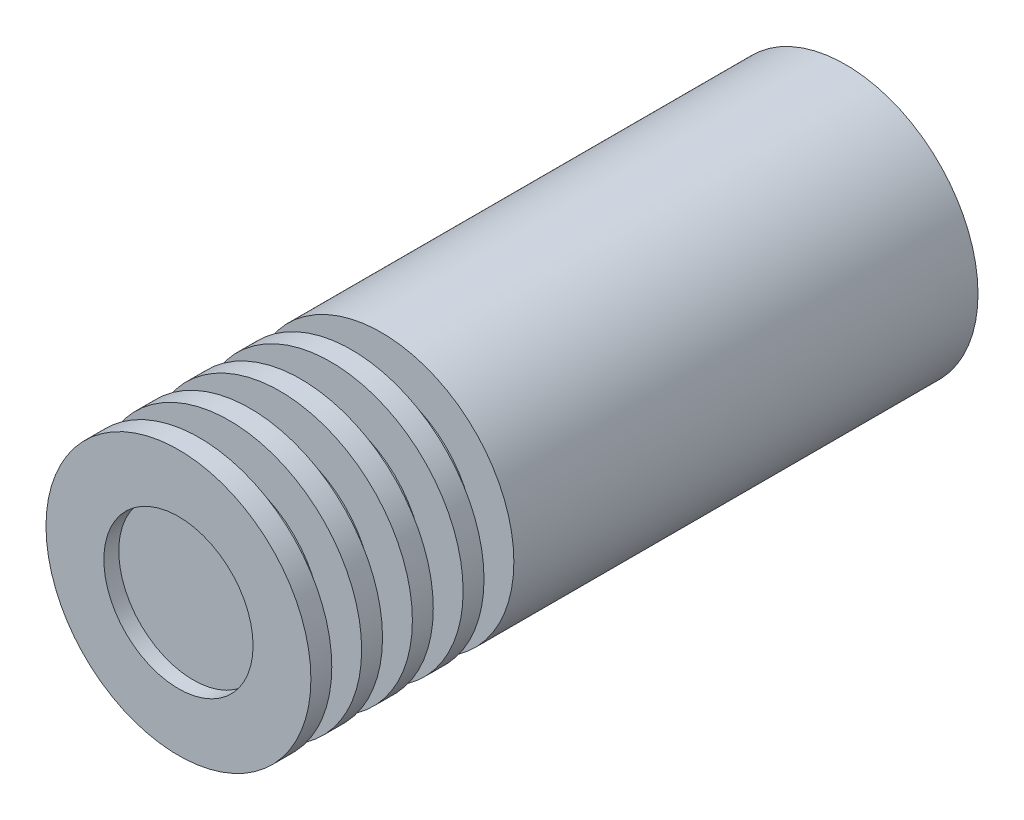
SolidWorks part; units mm, degrees
ref_plane "Ebene vorne" through (0, 0, 0) normal (0, 0, 1) x (1, 0, 0)
ref_plane "Ebene oben" through (0, 0, 0) normal (0, 1, 0) x (1, 0, 0)
ref_plane "Ebene rechts" through (0, 0, 0) normal (1, 0, 0) x (0, 0, -1)
sketch "Sketch1" plane through (0, 0, 0) normal (0, 0, 1) x (1, 0, 0)
  circle A0 centre (0, 0) radius 8.875
  dimension "D1" = 17.75
extrude "Boss-Extrude1" add sketch "Sketch1" along normal blind 44.7
sketch "Sketch2" plane through (0, 0, 0) normal (1, 0, 0) x (0, 0, -1)
  line L0 (0, 8.875) -> (-44.7, 8.875) construction
  line L1 (-43.3, 8.875) -> (-41.3, 8.875)
  line L2 (-43.3, 8.875) -> (-43.3, 6.175)
  line L3 (-43.3, 6.175) -> (-41.3, 6.175)
  line L4 (-41.3, 8.875) -> (-41.3, 6.175)
  line L5 (-44.7, 8.875) -> (-44.7, -8.875) construction
  line L6 (-39.9, 8.875) -> (-37.9, 8.875)
  line L7 (-39.9, 8.875) -> (-39.9, 6.175)
  line L8 (-39.9, 6.175) -> (-37.9, 6.175)
  line L9 (-37.9, 8.875) -> (-37.9, 6.175)
  line L10 (-36.5, 8.875) -> (-34.5, 8.875)
  line L11 (-36.5, 8.875) -> (-36.5, 6.175)
  line L12 (-36.5, 6.175) -> (-34.5, 6.175)
  line L13 (-34.5, 8.875) -> (-34.5, 6.175)
  line L14 (-33.1, 8.875) -> (-31.1, 8.875)
  line L15 (-33.1, 8.875) -> (-33.1, 6.175)
  line L16 (-33.1, 6.175) -> (-31.1, 6.175)
  line L17 (-31.1, 8.875) -> (-31.1, 6.175)
  line L18 (-44.7, 0) -> (0, 0) construction
  point P20 (-36.5, 7.525)
  dimension "D1" = 2
  dimension "D2" = 2
  dimension "D3" = 2
  dimension "D4" = 2
  dimension "D5" = 1.4
  dimension "D6" = 1.4
  dimension "D7" = 1.4
  dimension "D8" = 1.4
  dimension "D9" = 2.7
revolve "Cut-Revolve1" cut sketch "Sketch2" angle 360 about L18
sketch "Sketch3" plane through (0, 0, 44.7) normal (0, 0, 1) x (1, 0, 0)
  circle A0 centre (0, 0) radius 5
  dimension "D1" = 10
extrude "Cut-Extrude1" cut sketch "Sketch3" against normal blind 1
